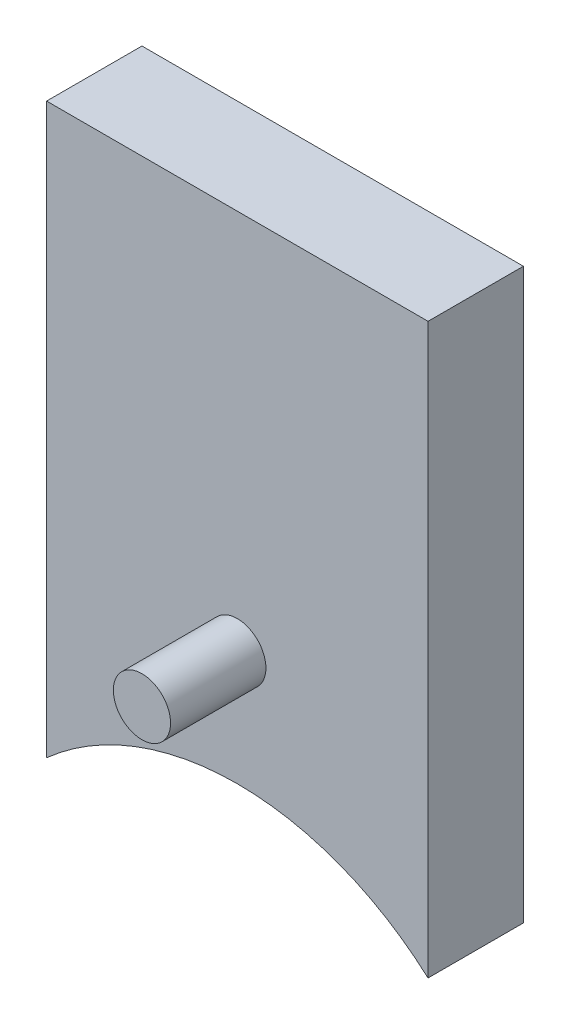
SolidWorks part; units mm, degrees
ref_plane "Front Plane" through (0, 0, 0) normal (0, 0, 1) x (1, 0, 0)
ref_plane "Top Plane" through (0, 0, 0) normal (0, 1, 0) x (1, 0, 0)
ref_plane "Right Plane" through (0, 0, 0) normal (1, 0, 0) x (0, 0, -1)
sketch "Sketch1" plane through (0, 0, 0) normal (0, 0, 1) x (1, 0, 0)
sketch_block_instance "Block-Slider-1"
sketch_block "Block-Slider" parameters "D5"=15, "D6"=3, "D1"=20, "D2"=20, "D3"=10, "D4"=21
extrude "Boss-Extrude1" add sketch "Sketch1" against normal blind 5
extrude "Boss-Extrude2" add sketch "Sketch1<3>" along normal mid plane 10
sketch "Sketch1<3>"
